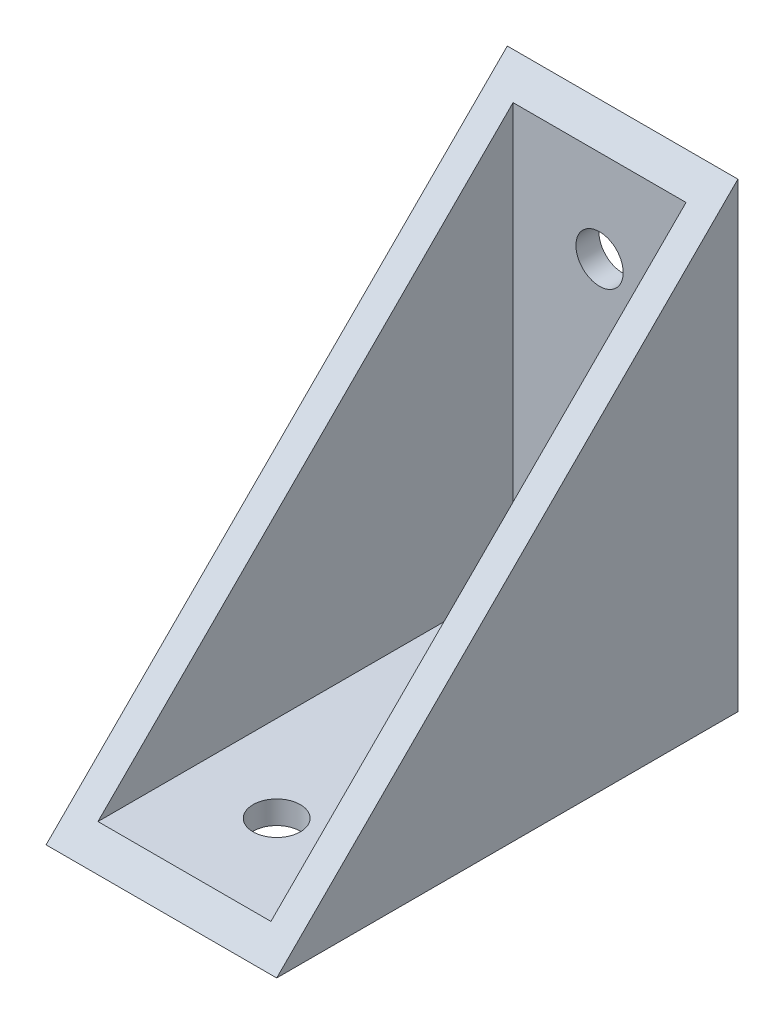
SolidWorks part; units mm, degrees
ref_plane "Ebene vorne" through (0, 0, 0) normal (0, 0, 1) x (1, 0, 0)
ref_plane "Ebene oben" through (0, 0, 0) normal (0, 1, 0) x (1, 0, 0)
ref_plane "Ebene rechts" through (0, 0, 0) normal (1, 0, 0) x (0, 0, -1)
sketch "Skizze1" plane through (0, 0, 0) normal (1, 0, 0) x (0, 0, -1)
  line L0 (-80, 0) -> (0, 80)
  line L3 (-80, 0) -> (0, 0)
  line L4 (0, 80) -> (0, 0)
  dimension "D1" = 80
  dimension "D2" = 80
extrude "Aufsatz-Linear austragen1" add sketch "Skizze1" along normal mid plane 40 separate body
sketch "Skizze2" plane through (0, 0, 0) normal (1, 0, 0) x (0, 0, -1)
  line L0 (-80, 0) -> (0, 0) construction
  line L1 (-91.8468, 84.9571) -> (-4, 84.9571)
  line L2 (-91.8468, 84.9571) -> (-91.8468, 4)
  line L3 (-91.8468, 4) -> (-4, 4)
  line L4 (-4, 84.9571) -> (-4, 4)
  line L5 (0, 0) -> (0, 80) construction
  dimension "D1" = 4
  dimension "D2" = 4
extrude "Schnitt-Linear austragen1" cut sketch "Skizze2" against normal mid plane 30
sketch "Skizze4" plane through (0, 0, 0) normal (0, -1, 0) x (1, 0, 0)
  line L0 (0, -53.599) -> (0, 53.599) construction
  line L1 (20, 80) -> (-20, 80) construction
  line L2 (-75.3045, 0) -> (89.5759, 0) construction
  line L3 (53.5395, 0) -> (-53.5395, 0) construction
  circle A0 centre (0, 60) radius 4.1
  circle A1 centre (0, 20) radius 4.1
  dimension "D3" = 8.2
  dimension "D4" = 8.2
  dimension "D1" = 20
  dimension "D2" = 60
extrude "Schnitt-Linear austragen2" cut sketch "Skizze4" against normal blind 30
sketch "Skizze5" plane through (0, 0, 0) normal (0, 0, -1) x (1, 0, 0)
  line L2 (-94.5117, -96.8841) -> (70.3687, -96.8841) construction
  line L4 (0, -53.599) -> (0, 53.599) construction
  line L5 (20, -80) -> (-20, -80) construction
  circle A0 centre (0, -20) radius 4.1
  circle A1 centre (0, -60) radius 4.1
  point P4 (0, 0)
  point P5 (0, 0)
  point P8 (0, 0)
  point P9 (0, 0)
  point P12 (0, 0)
  dimension "D3" = 8.2
  dimension "D4" = 8.2
  dimension "D2" = 60
  dimension "D1" = 20
extrude "Schnitt-Linear austragen3" cut sketch "Skizze5" against normal blind 30
